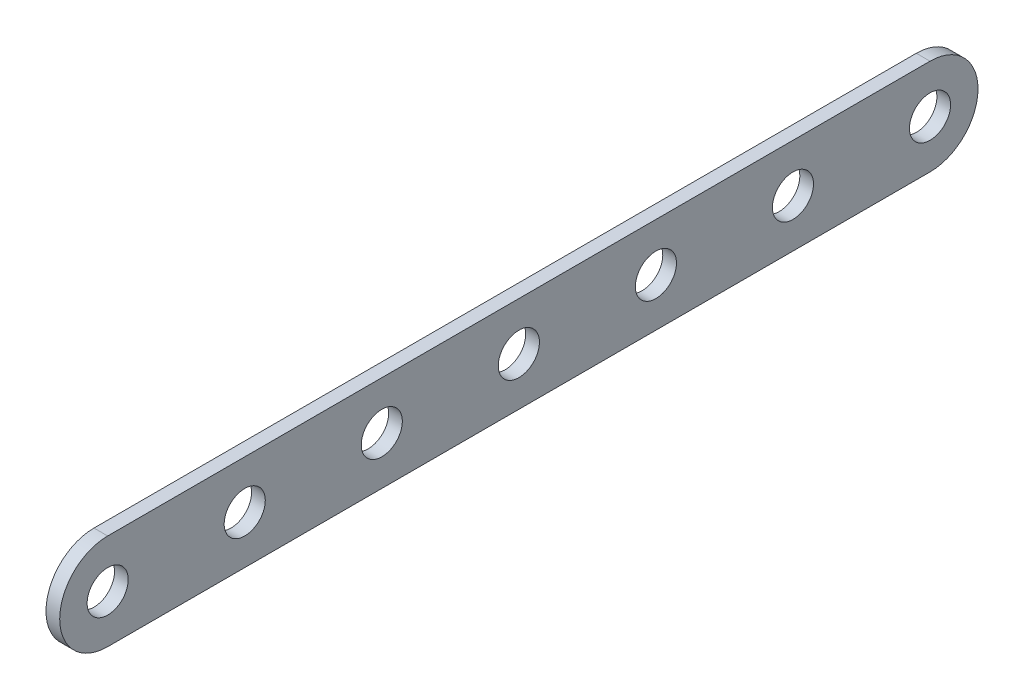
SolidWorks part; units mm, degrees
ref_plane "Front" through (0, 0, 0) normal (0, 0, 1) x (1, 0, 0)
ref_plane "Top" through (0, 0, 0) normal (0, 1, 0) x (1, 0, 0)
ref_plane "Right" through (0, 0, 0) normal (1, 0, 0) x (0, 0, -1)
sketch "Esquisse1" plane through (0, 0, 0) normal (1, 0, 0) x (0, 0, -1)
  line L0 (0, 0) -> (60, 0) construction
  line L1 (0, 3.5) -> (60, 3.5)
  line L2 (0, -3.5) -> (60, -3.5)
  arc A0 (0, 3.5) -> (0, -3.5) centre (0, 0) ccw
  arc A1 (60, -3.5) -> (60, 3.5) centre (60, 0) ccw
  circle A2 centre (0, 0) radius 1.5
  circle A3 centre (10, 0) radius 1.5
  circle A4 centre (20, 0) radius 1.5
  circle A5 centre (30, 0) radius 1.5
  circle A6 centre (40, 0) radius 1.5
  circle A7 centre (50, 0) radius 1.5
  circle A8 centre (60, 0) radius 1.5
  point P3 (30, 0)
  dimension "D3" = 3
  dimension "D1" = 7
  dimension "D2" = 60
  dimension "D5" = 10
  dimension "D4" = 7
extrude "Boss.-Extru.1" add sketch "Esquisse1" along normal blind 1
